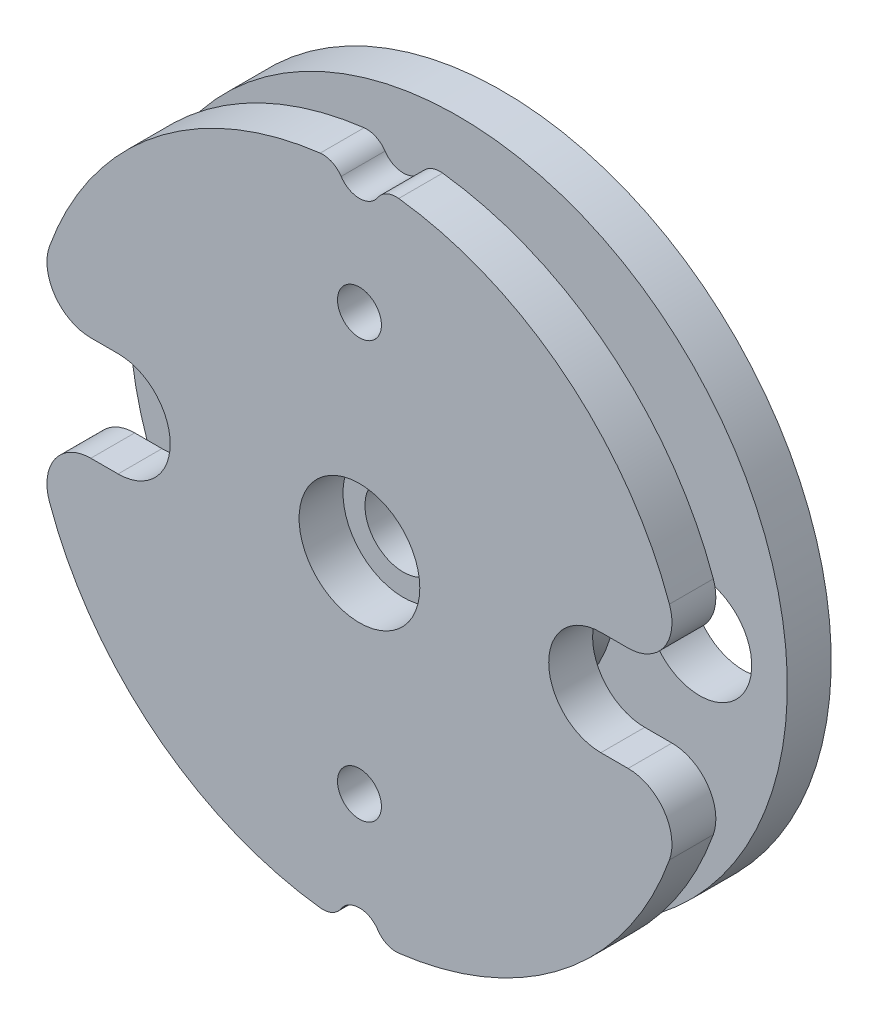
SolidWorks part; units mm, degrees
ref_plane "Front Plane" through (0, 0, 0) normal (0, 0, 1) x (1, 0, 0)
ref_plane "Top Plane" through (0, 0, 0) normal (0, 1, 0) x (1, 0, 0)
ref_plane "Right Plane" through (0, 0, 0) normal (1, 0, 0) x (0, 0, -1)
sketch "Sketch1" plane through (0, 0, 0) normal (0, 0, 1) x (1, 0, 0)
  circle A0 centre (0, 0) radius 15
  dimension "D1" = 30
extrude "Body" add sketch "Sketch1" along normal mid plane 6.5
sketch "Sketch2" plane through (0, 0, 0) normal (0, 0, 1) x (1, 0, 0)
  circle A0 centre (0, 0) radius 15
  circle A1 centre (0, 0) radius 6.5
  circle A2 centre (0, 0) radius 15 construction
  dimension "D1" = 13
extrude "Pulley Clearance" cut sketch "Sketch2" against normal mid plane 2.5
sketch "Sketch3" plane through (0, 0, 3.25) normal (0, 0, 1) x (1, 0, 0)
  circle A0 centre (0, 0) radius 1.75
  dimension "D1" = 3.5
extrude "Main Bolt Through Hole" cut sketch "Sketch3" against normal through all
sketch "Sketch4" plane through (0, 0, -3.25) normal (0, 0, -1) x (-1, 0, 0)
  circle A0 centre (0, 0) radius 5.25
  dimension "D1" = 10.5
extrude "Servo Horn Clearance" cut sketch "Sketch4" against normal blind 1.8
sketch "Sketch5" plane through (0, 0, 3.25) normal (0, 0, 1) x (1, 0, 0)
  circle A0 centre (0, 0) radius 2.75
  dimension "D1" = 5.5
extrude "Main Bolt Clearance" cut sketch "Sketch5" against normal blind 2
sketch "Sketch6" plane through (0, 0, -3.25) normal (0, 0, -1) x (-1, 0, 0)
  line L0 (-15, 0) -> (15, 0) construction
  line L1 (0, 15) -> (0, -15) construction
  circle A0 centre (0, 0) radius 15 construction
  circle A1 centre (-11, 0) radius 2.375
  circle A2 centre (11, 0) radius 2.375
  dimension "D1" = 4.75
  dimension "D2" = 22
extrude "Horn Attachment Holes" cut sketch "Sketch6" against normal through all
sketch "Sketch7" plane through (0, 0, 3.25) normal (0, 0, 1) x (1, 0, 0)
  line L0 (11, -2.375) -> (11, 2.375)
  line L1 (11, 2.375) -> (14.8108, 2.375)
  line L2 (11, -2.375) -> (14.8108, -2.375)
  line L3 (0, 15) -> (0, -15) construction
  line L4 (-11, -2.375) -> (-14.8108, -2.375)
  line L5 (-11, 2.375) -> (-14.8108, 2.375)
  line L6 (-11, -2.375) -> (-11, 2.375)
  circle A0 centre (11, 0) radius 2.375 construction
  circle A1 centre (0, 0) radius 15 construction
  arc A2 (14.8108, -2.375) -> (14.8108, 2.375) centre (0, 0) ccw
  arc A3 (-14.8108, -2.375) -> (-14.8108, 2.375) centre (0, 0) cw
extrude "Horn Attachment Clearance" cut sketch "Sketch7" against normal up to surface (2 mm away)
sketch "Sketch8" plane through (0, 0, 3.25) normal (0, 0, 1) x (1, 0, 0)
  line L0 (0, -15) -> (0, 15) construction
  line L1 (0, 0) -> (6.5, 0) construction
  circle A0 centre (0, 0) radius 6.5 construction
  circle A1 centre (0, 0) radius 6.5 construction
  arc A2 (-14.8108, -2.375) -> (14.8108, -2.375) centre (0, 0) ccw construction
  arc A3 (14.8108, 2.375) -> (-14.8108, 2.375) centre (0, 0) ccw construction
  circle A4 centre (0, 9.5) radius 1
  circle A5 centre (0, 15) radius 1
  circle A6 centre (0, -15) radius 1
  circle A7 centre (0, -9.5) radius 1
  point P16 (0, 6.5)
  dimension "D1" = 2
  dimension "D2" = 3
extrude "Tendon Anchor" cut sketch "Sketch8" against normal up to surface (2 mm away)
fillet "Contouring 1" radius 2 4 edges at (14.8108, 2.375, 2.25) (14.8108, -2.375, 2.25) (-14.8108, 2.375, 2.25) (-14.8108, -2.375, 2.25)
chamfer "Inner Chamfer" distance 0.75 angle 45 2 edges at (6.5, 0, 1.25) (6.5, 0, -1.25)
fillet "Contouring 2" radius 1 4 edges at (-0.9994, 14.9667, 2.25) (0.9994, 14.9667, 2.25) (0.9994, -14.9667, 2.25) (-0.9994, -14.9667, 2.25)
ref_point "Ref Center"
